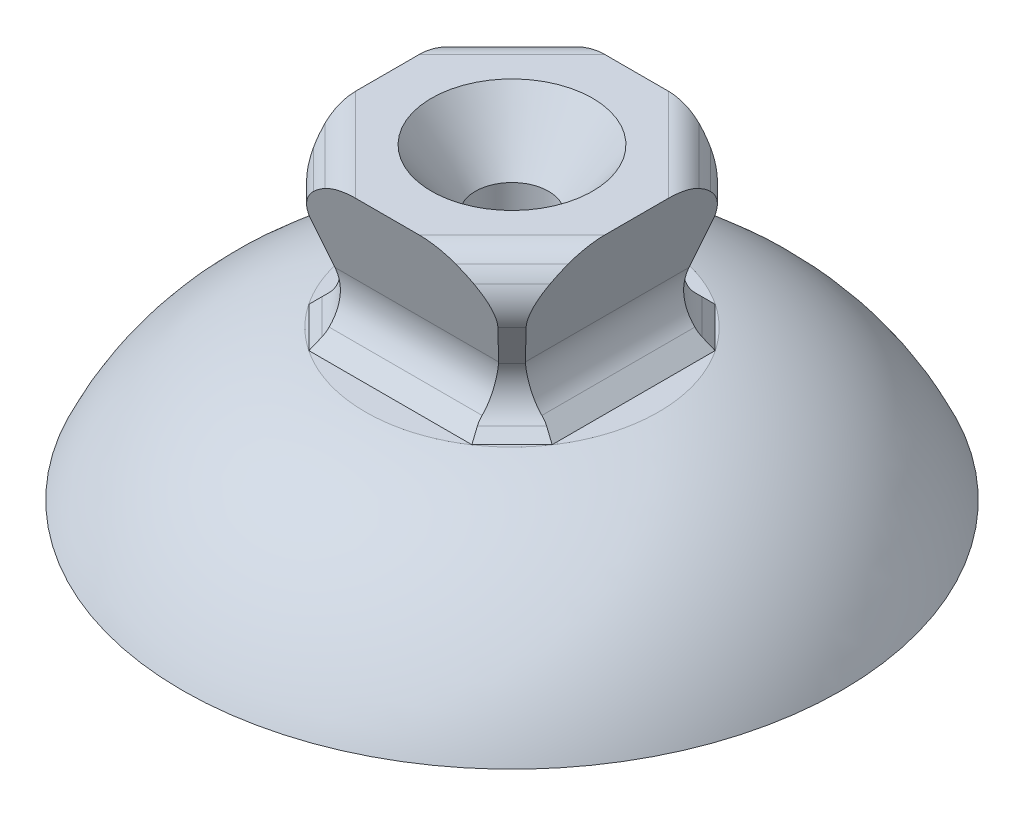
SolidWorks part; units mm, degrees
ref_plane "Front Plane" through (0, 0, 0) normal (0, 0, 1) x (1, 0, 0)
ref_plane "Top Plane" through (0, 0, 0) normal (0, 1, 0) x (1, 0, 0)
ref_plane "Right Plane" through (0, 0, 0) normal (1, 0, 0) x (0, 0, -1)
sketch "Sketch4" plane through (0, 0, 0) normal (0, 0, 1) x (1, 0, 0)
  line L1 (-8.5, -5.5) -> (8.5, -5.5)
  line L2 (-8.5, -5.5) -> (-8.5, 5.5)
  line L3 (-8.5, 5.5) -> (8.5, 5.5)
  line L4 (8.5, -5.5) -> (8.5, 5.5)
  line L5 (-8.5, -5.5) -> (8.5, 5.5) construction
  line L6 (-8.5, 5.5) -> (8.5, -5.5) construction
  point P0 (0, 0)
  dimension "D1" = 11
  dimension "D2" = 17
extrude "Boss-Extrude2" add sketch "Sketch4" along normal mid plane 17
sketch "Sketch5" plane through (0, 0, 0) normal (1, 0, 0) x (0, 0, -1)
  line L0 (0, -10) -> (0, 10) construction
  line L1 (8.5, 5.5) -> (6.5025, -1.2915)
  line L2 (8.5, -5.5) -> (7.2593, -4.2593)
  line L3 (-8.5, -5.5) -> (-7.2593, -4.2593)
  line L4 (-8.5, 5.5) -> (-6.5025, -1.2915)
  line L5 (-8.5, 5.5) -> (-8.5, -5.5)
  line L6 (8.5, -5.5) -> (8.5, 5.5)
  arc A0 (7.2593, -4.2593) -> (6.5025, -1.2915) centre (9.3806, -2.138) cw
  arc A1 (-7.2593, -4.2593) -> (-6.5025, -1.2915) centre (-9.3806, -2.138) ccw
  point P12 (6, -3)
  point P16 (-6, -3)
  dimension "D5" = 3
  dimension "D1" = 10
  dimension "D2" = 20
  dimension "D3" = 6
  dimension "D4" = 45
extrude "Cut-Extrude1" cut sketch "Sketch5" against normal mid plane 27
sketch "Sketch7" plane through (0, 0, 0) normal (0, 0, 1) x (1, 0, 0)
  line L0 (0, -10) -> (0, 10) construction
  line L1 (8.5, 5.5) -> (6.5025, -1.2915)
  line L2 (8.5, -5.5) -> (7.2593, -4.2593)
  line L3 (-8.5, -5.5) -> (-7.2593, -4.2593)
  line L4 (-8.5, 5.5) -> (-6.5025, -1.2915)
  line L5 (-8.5, 5.5) -> (-8.5, -5.5)
  line L6 (8.5, -5.5) -> (8.5, 5.5)
  line L7 (8.5, -4.2593) -> (8.5, -5.5) construction
  arc A0 (7.2593, -4.2593) -> (6.5025, -1.2915) centre (9.3806, -2.138) cw
  arc A1 (-7.2593, -4.2593) -> (-6.5025, -1.2915) centre (-9.3806, -2.138) ccw
  point P12 (-6, -3)
  dimension "D3" = 3
  dimension "D1" = 20
  dimension "D2" = 45
  dimension "D4" = 16.389
extrude "Cut-Extrude2" cut sketch "Sketch7" against normal mid plane 27
sketch "Sketch8" plane through (0, 5.5, 0) normal (0, 1, 0) x (1, 0, 0)
  line L0 (3.5355, 3.5355) -> (-3.5355, -3.5355) construction
  line L1 (-5, 0) -> (5, 0) construction
  line L2 (-3.5355, 3.5355) -> (3.5355, -3.5355) construction
  line L3 (0, 5) -> (0, -5) construction
  dimension "D1" = 10
  dimension "D2" = 10
  dimension "D3" = 10
  dimension "D4" = 45
  dimension "D5" = 45
  dimension "D6" = 10
sketch "Sketch9" plane through (0, 0, 0) normal (0, 1, 0) x (1, 0, 0)
  line L0 (3.5355, 3.5355) -> (-3.5355, -3.5355) construction
  line L1 (-5, 0) -> (5, 0) construction
  line L2 (-3.5355, 3.5355) -> (3.5355, -3.5355) construction
  line L3 (0, 5) -> (0, -5) construction
  point P8 (0, 0)
  point P10 (0, 0)
  point P11 (0, 0)
  dimension "D1" = 10
  dimension "D2" = 10
  dimension "D3" = 10
  dimension "D4" = 45
  dimension "D5" = 45
  dimension "D6" = 10
ref_plane "Plane1" through (0, 0, 0) normal (0.7071, 0, 0.7071) x (0.7071, 0, -0.7071)
ref_plane "Plane2" through (0, 0, 0) normal (0.7071, 0, -0.7071) x (-0.7071, 0, -0.7071)
sketch "Sketch11" plane through (0, 0, 0) normal (0.7071, 0, 0.7071) x (0.7071, 0, -0.7071)
  line L0 (-10, 5.5) -> (10, 5.5) construction
  line L1 (0, -5.5) -> (0, 5.5) construction
  line L2 (10, 5.5) -> (10, -5.5) construction
  line L3 (0, -5.5) -> (12.0208, -5.5) construction
  line L4 (10, -5.5) -> (0, -5.5) construction
  line L5 (10, -5.5) -> (9.1595, -4.6595)
  line L6 (10, 5.5) -> (10, 2.3) construction
  line L7 (0, 5.5) -> (8.25, 5.5) construction
  line L8 (9.6935, 1.5413) -> (8.4993, -1.4144)
  line L10 (10, -5.5) -> (14, -5.5)
  line L11 (14, -5.5) -> (14, 5.5)
  line L12 (14, 5.5) -> (8.25, 5.5)
  line L13 (-14, 5.5) -> (-8.25, 5.5)
  line L14 (-9.6935, 1.5413) -> (-8.4993, -1.4144)
  line L15 (-10, -5.5) -> (-9.1595, -4.6595)
  line L16 (-10, -5.5) -> (-14, -5.5)
  line L17 (-14, -5.5) -> (-14, 5.5)
  arc A0 (9.5819, 4.0331) -> (8.25, 5.5) centre (6.1993, 2.3) ccw
  arc A1 (9.5819, 4.0331) -> (9.6935, 1.5413) centre (6.9119, 2.6651) cw
  arc A2 (9.1595, -4.6595) -> (8.4993, -1.4144) centre (11.2808, -2.5382) cw
  arc A3 (-9.5819, 4.0331) -> (-9.6935, 1.5413) centre (-6.9119, 2.6651) ccw
  arc A4 (-9.5819, 4.0331) -> (-8.25, 5.5) centre (-6.1993, 2.3) cw
  arc A5 (-9.1595, -4.6595) -> (-8.4993, -1.4144) centre (-11.2808, -2.5382) ccw
  dimension "D7" = 3
  dimension "D8" = 3
  dimension "D1" = 20
  dimension "D2" = 11
  dimension "D3" = 45
  dimension "D4" = 8.25
  dimension "D5" = 3.2
  dimension "D6" = 22
  dimension "D9" = 4
extrude "Cut-Extrude3" cut sketch "Sketch11" against normal mid plane 27
sketch "Sketch12" plane through (0, 0, 0) normal (0.7071, 0, -0.7071) x (-0.7071, 0, -0.7071)
  line L0 (-10, 5.5) -> (10, 5.5) construction
  line L1 (0, -5.5) -> (0, 5.5) construction
  line L2 (10, 5.5) -> (10, -5.5) construction
  line L3 (10, -5.5) -> (0, -5.5) construction
  line L4 (10, -5.5) -> (9.1595, -4.6595)
  line L5 (10, 5.5) -> (10, 2.3) construction
  line L6 (0, 5.5) -> (8.25, 5.5) construction
  line L7 (9.6935, 1.5413) -> (8.4993, -1.4144)
  line L8 (10, -5.5) -> (14, -5.5)
  line L9 (14, -5.5) -> (14, 5.5)
  line L10 (14, 5.5) -> (8.25, 5.5)
  line L11 (-14, 5.5) -> (-8.25, 5.5)
  line L12 (-9.6935, 1.5413) -> (-8.4993, -1.4144)
  line L13 (-10, -5.5) -> (-9.1595, -4.6595)
  line L14 (-10, -5.5) -> (-14, -5.5)
  line L15 (-14, -5.5) -> (-14, 5.5)
  arc A0 (9.5819, 4.0331) -> (8.25, 5.5) centre (6.1993, 2.3) ccw
  arc A1 (9.5819, 4.0331) -> (9.6935, 1.5413) centre (6.9119, 2.6651) cw
  arc A2 (9.1595, -4.6595) -> (8.4993, -1.4144) centre (11.2808, -2.5382) cw
  arc A3 (-9.5819, 4.0331) -> (-9.6935, 1.5413) centre (-6.9119, 2.6651) ccw
  arc A4 (-9.5819, 4.0331) -> (-8.25, 5.5) centre (-6.1993, 2.3) cw
  arc A5 (-9.1595, -4.6595) -> (-8.4993, -1.4144) centre (-11.2808, -2.5382) ccw
  dimension "D7" = 3
  dimension "D8" = 3
  dimension "D1" = 20
  dimension "D2" = 11
  dimension "D3" = 45
  dimension "D4" = 8.25
  dimension "D5" = 3.2
  dimension "D6" = 22
  dimension "D9" = 4
extrude "Cut-Extrude4" cut sketch "Sketch12" against normal mid plane 27
sketch "Sketch14" plane through (0, 0, 0) normal (0, 0, 1) x (1, 0, 0)
  line L0 (0, 5.5) -> (0, -5.5) construction
  line L1 (0, 5.5) -> (5.5, 5.5)
  line L2 (3.1673, 5.5) -> (8.5, 5.5) construction
  line L3 (5.5, 5.5) -> (5.5, 1.5) construction
  line L4 (0, 1.5) -> (2.5, 1.5) construction
  line L5 (2.5, 1.5) -> (5.5, 5.5)
  line L6 (2.5, 1.5) -> (2.5, -5.5)
  line L7 (-5.6421, -5.5) -> (5.6421, -5.5) construction
  line L8 (0, -5.5) -> (0, 5.5)
  line L9 (2.5, -5.5) -> (0, -5.5)
  dimension "D1" = 11
  dimension "D2" = 5.5
  dimension "D3" = 4
  dimension "D4" = 2.5
revolve "Cut-Revolve1" cut sketch "Sketch14" angle 360 about L8
fillet "Fillet1" radius 2 4 edges at (5.8336, 5.5, -5.8336) (-5.8336, 5.5, -5.8336) (-5.8336, 5.5, 5.8336) (5.8336, 5.5, 5.8336)
sketch "Sketch15" plane through (0, 0, 0) normal (1, 0, 0) x (0, 0, -1)
  line L0 (0, -5.5) -> (0, -15.5) construction
  line L1 (-5.6421, -5.5) -> (5.6421, -5.5) construction
  line L3 (0, -15.5) -> (22.5, -15.5)
  line L4 (0, -15.5) -> (0, -5.5)
  line L5 (0, -5.5) -> (0, -5.3)
  line L6 (0, -5.3) -> (9.998, -5.3)
  arc A0 (9.998, -5.3) -> (22.5, -15.5) centre (6.077, -22.8677) cw
  dimension "D4" = 18
  dimension "D1" = 10
  dimension "D2" = 10
  dimension "D3" = 22.5
  dimension "D5" = 0.2
revolve "Revolve1" add sketch "Sketch15" angle 360 about L0
